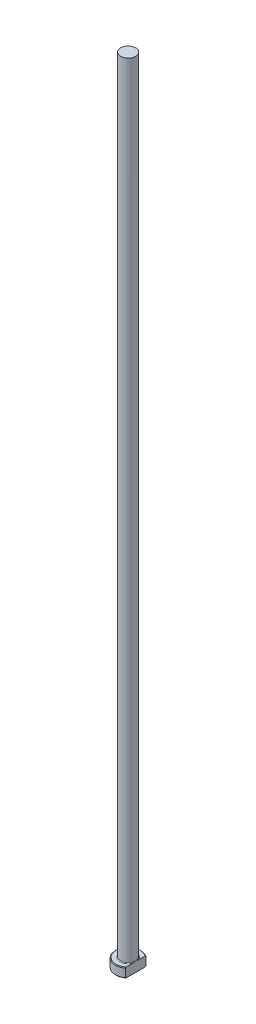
SolidWorks part; units mm, degrees
ref_plane "Front Plane" through (0, 0, 0) normal (0, 0, 1) x (1, 0, 0)
ref_plane "Top Plane" through (0, 0, 0) normal (0, 1, 0) x (1, 0, 0)
ref_plane "Right Plane" through (0, 0, 0) normal (1, 0, 0) x (0, 0, -1)
sketch "Sketch1" plane through (0, 0, 0) normal (0, 0, 1) x (1, 0, 0)
  line L0 (0, 259.9588) -> (0, -15.1925) construction
  line L1 (0, 0) -> (-4, 0)
  line L2 (-4, 0) -> (-4, 3)
  line L3 (-4, 3) -> (-2.35, 3)
  line L4 (-2.35, 3) -> (-2.35, 250)
  line L5 (-2.35, 250) -> (0, 250)
  line L6 (0, 250) -> (0, 0)
  dimension "L" = 250
  dimension "H" = 8
  dimension "T" = 3
  dimension "D" = 4.7
revolve "Revolve1" add sketch "Sketch1" angle 360 about L0
chamfer "Chamfer1" distance 0.2 angle 45 2 edges at (0, 3, 4) (0, 0, 4)
fillet "Fillet1" radius 0.2 1 edges at (0, 3, 2.35)
sketch "Sketch2" plane through (0, 0, 0) normal (0, 1, 0) x (1, 0, 0)
  line L0 (2.35, 3.2369) -> (2.35, -3.2369)
  circle A0 centre (0, 0) radius 4 construction
  arc A1 (2.35, -3.2369) -> (2.35, 3.2369) centre (0, 0) ccw
  circle A2 centre (0, 0) radius 2.35 construction
extrude "KEY" cut sketch "Sketch2" along normal through all
